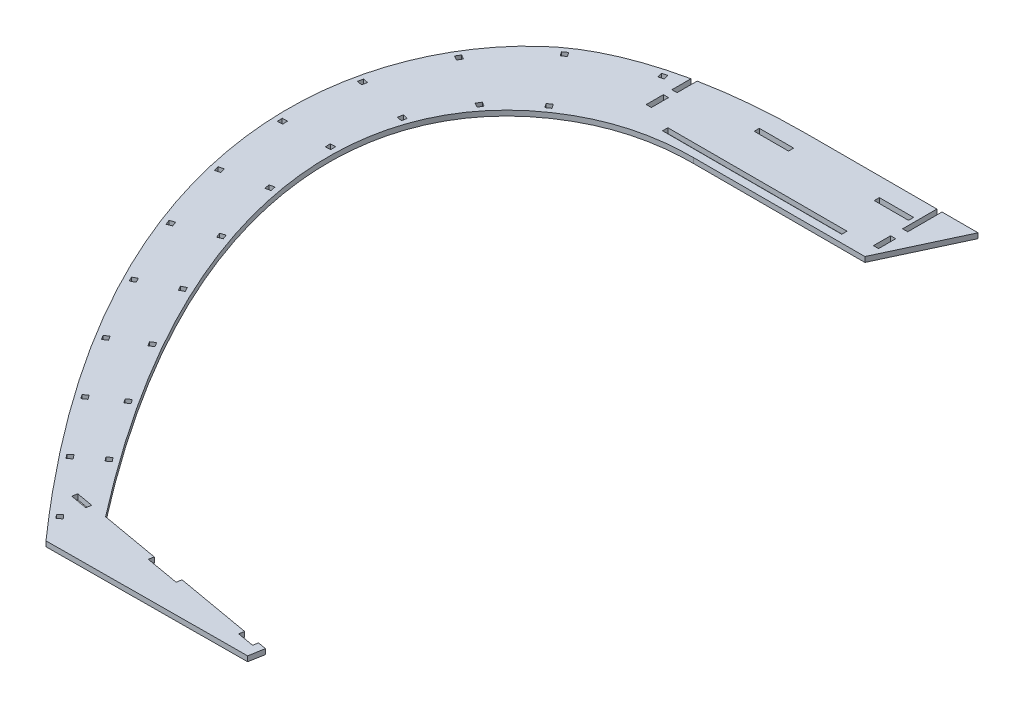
SolidWorks part; units mm, degrees
ref_plane "Front Plane" through (0, 0, 0) normal (0, 0, 1) x (1, 0, 0)
ref_plane "Top Plane" through (0, 0, 0) normal (0, 1, 0) x (1, 0, 0)
ref_plane "Right Plane" through (0, 0, 0) normal (1, 0, 0) x (0, 0, -1)
sketch "Sketch1" plane through (0, 0, 0) normal (0, 1, 0) x (1, 0, 0)
  line L0 (0, 300) -> (0, 250) construction
  line L1 (0, 300) -> (150, 300) construction
  line L2 (0, 250) -> (150, 250) construction
  line L3 (150, 300) -> (150, 250) construction
  line L4 (0, 134.7387) -> (-116.8574, 17.8813) construction
  line L5 (0, 0) -> (0, 134.7387) construction
  line L6 (-116.8574, 17.8813) -> (112.6432, -211.6192) construction
  line L7 (-81.502, 53.2367) -> (112.6432, -140.9086) construction
  line L8 (112.6432, -140.9086) -> (112.6432, -211.6192) construction
  line L9 (112.6432, -211.6192) -> (162.6432, -161.6192) construction
  line L10 (162.6432, -161.6192) -> (162.6432, -232.3299) construction
  line L11 (112.6432, -140.9086) -> (162.6432, -90.9086) construction
  circle A0 centre (0, 0) radius 300 construction
  circle A1 centre (0, 134.7387) radius 115.2613 construction
  circle A2 centre (0, 134.7387) radius 165.2613 construction
  circle A3 centre (162.6432, -161.6192) radius 70.7107 construction
  circle A4 centre (162.6432, -90.9086) radius 70.7107 construction
  point P3 (75, 250)
  point P11 (-81.502, 53.2367)
  dimension "D1" = 600
  dimension "D2" = 150
  dimension "D3" = 50
  dimension "D4" = 45
sketch "Sketch2" plane through (0, 0, 0) normal (0, 1, 0) x (1, 0, 0)
  line L0 (20.9838, 45) -> (0, 0) construction
  line L1 (10, -352.9066) -> (123.2529, -372.8762)
  line L2 (123.2529, -372.8762) -> (121.6901, -381.7394)
  line L3 (121.6901, -381.7394) -> (4.7906, -382.4509)
  line L4 (10, -352.9066) -> (4.7906, -382.4509) construction
  line L5 (20.9838, 45) -> (120.9838, 45)
  line L6 (120.9838, 45) -> (100, 0)
  line L7 (100, 0) -> (0, 0)
  line L8 (0, 0) -> (0, -110.6621) construction
  line L9 (50, -381.7394) -> (121.6901, -381.7394) construction
  line L10 (10, -352.9066) -> (50, -352.9066) construction
  line L11 (-66, -20) -> (0, -20) construction
  line L12 (-90, 20) -> (0, 20) construction
  line L13 (0, 20) -> (0, 0) construction
  line L14 (-40, -110.6621) -> (44.7394, -110.6621) construction
  line L15 (50, -110.6621) -> (50, -478.8076) construction
  spline S0 degree 3 poles (20.9838, 45) (-20.2558, 45) (-69.1326, 35.8836) (-141.8762, -17.4106) (-193.8055, -157.8474) (4.7906, -382.4509) knots 0 0 0 0 0.294229 0.394229 1 1 1 1
  spline S1 degree 3 poles (0, 0) (-24.996, 0) (-123.9056, -31.9645) (-137.3281, -162.5738) (10, -352.9066) knots 0 0 0 0 0.197472 1 1 1 1
  dimension "D1" = 45
  dimension "D2" = 100
  dimension "D3" = 115
  dimension "D4" = 385
  dimension "D5" = 9
  dimension "D6" = 100
  dimension "D7" = 40
  dimension "D8" = 115
  dimension "D9" = 30
  dimension "D10" = 90
  dimension "D11" = 66
  dimension "D12" = 20
  dimension "D13" = 20
  dimension "D14" = 50
extrude "Boss-Extrude1" add sketch "Sketch2" along normal blind 3
sketch "Sketch3" plane through (0, 0, 0) normal (0, 1, 0) x (1, 0, 0)
  line L0 (-51.9129, 33.2319) -> (-49.0162, 34.0121)
  line L1 (-51.9129, 33.2319) -> (-51.1328, 30.3352)
  line L2 (-49.0162, 34.0121) -> (-48.236, 31.1153)
  line L3 (-51.1328, 30.3352) -> (-48.236, 31.1153)
  line L4 (-89.5043, 16.7179) -> (-91.9494, 14.9798)
  line L5 (-89.5043, 16.7179) -> (-87.7661, 14.2728)
  line L6 (-91.9494, 14.9798) -> (-90.2113, 12.5346)
  line L7 (-87.7661, 14.2728) -> (-90.2113, 12.5346)
  line L8 (-120.9663, -18.3389) -> (-119.4273, -15.7637)
  line L9 (-120.9663, -18.3389) -> (-118.3911, -19.8779)
  line L10 (-119.4273, -15.7637) -> (-116.8521, -17.3027)
  line L11 (-118.3911, -19.8779) -> (-116.8521, -17.3027)
  line L12 (-135.8569, -56.5018) -> (-136.4986, -59.4323)
  line L13 (-135.8569, -56.5018) -> (-132.9263, -57.1435)
  line L14 (-136.4986, -59.4323) -> (-133.5681, -60.0741)
  line L15 (-132.9263, -57.1435) -> (-133.5681, -60.0741)
  line L16 (-139.8016, -100.0657) -> (-139.6788, -103.0632)
  line L17 (-139.8016, -100.0657) -> (-136.8041, -99.943)
  line L18 (-139.6788, -103.0632) -> (-136.6813, -102.9404)
  line L19 (-136.8041, -99.943) -> (-136.6813, -102.9404)
  line L20 (-51.1328, 30.3352) -> (-87.7661, 14.2728) construction
  line L21 (-90.2113, 12.5346) -> (-116.8521, -17.3027) construction
  line L22 (-118.3911, -19.8779) -> (-132.9263, -57.1435) construction
  line L23 (-133.5681, -60.0741) -> (-136.8041, -99.943) construction
  line L24 (-133.9752, -143.2286) -> (-133.2894, -146.1491)
  line L25 (-133.9752, -143.2286) -> (-131.0547, -142.5427)
  line L26 (-133.2894, -146.1491) -> (-130.3688, -145.4633)
  line L27 (-131.0547, -142.5427) -> (-130.3688, -145.4633)
  line L28 (-121.2031, -184.7151) -> (-120.1203, -187.5129)
  line L29 (-121.2031, -184.7151) -> (-118.4053, -183.6323)
  line L30 (-120.1203, -187.5129) -> (-117.3225, -186.4301)
  line L31 (-118.4053, -183.6323) -> (-117.3225, -186.4301)
  line L32 (-103.554, -224.2616) -> (-102.1882, -226.9326)
  line L33 (-103.554, -224.2616) -> (-100.883, -222.8957)
  line L34 (-102.1882, -226.9326) -> (-99.5172, -225.5668)
  line L35 (-100.883, -222.8957) -> (-99.5172, -225.5668)
  line L36 (-82.3978, -261.9679) -> (-80.824, -264.522)
  line L37 (-82.3978, -261.9679) -> (-79.8437, -260.3942)
  line L38 (-80.824, -264.522) -> (-78.2699, -262.9483)
  line L39 (-79.8437, -260.3942) -> (-78.2699, -262.9483)
  line L40 (-58.6351, -298.03) -> (-56.9039, -300.4801)
  line L41 (-58.6351, -298.03) -> (-56.185, -296.2988)
  line L42 (-56.9039, -300.4801) -> (-54.4538, -298.7489)
  line L43 (-56.185, -296.2988) -> (-54.4538, -298.7489)
  line L44 (-32.8737, -332.649) -> (-31.0196, -335.0075)
  line L45 (-32.8737, -332.649) -> (-30.5153, -330.7949)
  line L46 (-31.0196, -335.0075) -> (-28.6612, -333.1534)
  line L47 (-30.5153, -330.7949) -> (-28.6612, -333.1534)
  line L48 (-5.536, -366.0039) -> (-3.5836, -368.2816)
  line L49 (-5.536, -366.0039) -> (-3.2583, -364.0515)
  line L50 (-3.5836, -368.2816) -> (-1.3059, -366.3292)
  line L51 (-3.2583, -364.0515) -> (-1.3059, -366.3292)
  line L52 (-88.9887, 13.4037) -> (-69.0562, -14.8114) construction
  line L53 (-117.6216, -18.5903) -> (-90.3606, -34.8824) construction
  line L54 (-133.2472, -58.6088) -> (-106.4359, -64.4803) construction
  line L55 (-136.7427, -101.4417) -> (-112.8211, -100.4618) construction
  line L56 (-130.7118, -144.003) -> (-109.7317, -139.0763) construction
  line L57 (-117.8639, -185.0312) -> (-99.3976, -177.8842) construction
  line L58 (-100.2001, -224.2312) -> (-83.9353, -215.9142) construction
  line L59 (-79.0568, -261.6713) -> (-64.822, -252.9006) construction
  line L60 (-55.3194, -297.5239) -> (-43.0245, -288.8363) construction
  line L61 (-29.5882, -331.9741) -> (-19.1851, -323.7958) construction
  line L62 (-79.0224, -0.7039) -> (-75.3617, 1.8822) construction
  line L63 (-67.8285, -13.9495) -> (-70.2838, -15.6733)
  line L64 (-68.56, -18.1286) -> (-70.2838, -15.6733)
  line L65 (-66.1047, -16.4048) -> (-67.8285, -13.9495)
  line L66 (-103.9911, -26.7364) -> (-102.1882, -23.7197) construction
  line L67 (-91.1301, -36.17) -> (-89.5911, -33.5948)
  line L68 (-87.0159, -35.1338) -> (-89.5911, -33.5948)
  line L69 (-88.5549, -37.709) -> (-91.1301, -36.17)
  line L70 (-88.5549, -37.709) -> (-87.0159, -35.1338)
  line L71 (-119.8416, -61.5445) -> (-119.4273, -59.6527) construction
  line L72 (-124.7819, -100.9518) -> (-124.8403, -99.5263) construction
  line L73 (-120.2217, -141.5396) -> (-121.2031, -137.3605) construction
  line L74 (-108.6308, -181.4577) -> (-109.7317, -178.6132) construction
  line L75 (-92.0677, -220.0727) -> (-93.4934, -217.2847) construction
  line L76 (-106.115, -63.015) -> (-106.7568, -65.9455)
  line L77 (-103.8262, -66.5873) -> (-106.7568, -65.9455)
  line L78 (-103.1845, -63.6567) -> (-106.115, -63.015)
  line L79 (-103.1845, -63.6567) -> (-103.8262, -66.5873)
  line L80 (-112.8825, -98.9631) -> (-112.7597, -101.9606)
  line L81 (-109.7623, -101.8378) -> (-112.7597, -101.9606)
  line L82 (-109.885, -98.8403) -> (-112.8825, -98.9631)
  line L83 (-109.885, -98.8403) -> (-109.7623, -101.8378)
  line L84 (-110.0746, -137.616) -> (-109.3887, -140.5366)
  line L85 (-106.4682, -139.8507) -> (-109.3887, -140.5366)
  line L86 (-107.154, -136.9302) -> (-110.0746, -137.616)
  line L87 (-107.154, -136.9302) -> (-106.4682, -139.8507)
  line L88 (-99.939, -176.4853) -> (-98.8562, -179.2831)
  line L89 (-96.0584, -178.2003) -> (-98.8562, -179.2831)
  line L90 (-97.1412, -175.4025) -> (-99.939, -176.4853)
  line L91 (-97.1412, -175.4025) -> (-96.0584, -178.2003)
  line L92 (-84.6183, -214.5787) -> (-83.2524, -217.2497)
  line L93 (-80.5814, -215.8839) -> (-83.2524, -217.2497)
  line L94 (-81.9472, -213.2128) -> (-84.6183, -214.5787)
  line L95 (-81.9472, -213.2128) -> (-80.5814, -215.8839)
  line L96 (-71.9394, -257.2859) -> (-72.8997, -255.7274) construction
  line L97 (-49.1719, -293.1801) -> (-50.6326, -291.1129) construction
  line L98 (-24.3866, -327.885) -> (-25.7693, -326.1261) construction
  line L99 (-65.6089, -251.6235) -> (-64.0352, -254.1776)
  line L100 (-61.4811, -252.6039) -> (-64.0352, -254.1776)
  line L101 (-63.0548, -250.0498) -> (-65.6089, -251.6235)
  line L102 (-66.1047, -16.4048) -> (-68.56, -18.1286)
  line L103 (-63.0548, -250.0498) -> (-61.4811, -252.6039)
  line L104 (-43.8901, -287.6113) -> (-42.1589, -290.0614)
  line L105 (-39.7088, -288.3302) -> (-42.1589, -290.0614)
  line L106 (-41.44, -285.8801) -> (-43.8901, -287.6113)
  line L107 (-41.44, -285.8801) -> (-39.7088, -288.3302)
  line L108 (-20.1121, -322.6166) -> (-18.258, -324.975)
  line L109 (-15.8996, -323.1209) -> (-18.258, -324.975)
  line L110 (-17.7537, -320.7625) -> (-20.1121, -322.6166)
  line L111 (-17.7537, -320.7625) -> (-15.8996, -323.1209)
  line L120 (-136.6813, -102.9404) -> (-131.0547, -142.5427) construction
  line L121 (-130.3688, -145.4633) -> (-118.4053, -183.6323) construction
  line L122 (-117.3225, -186.4301) -> (-100.883, -222.8957) construction
  line L123 (-99.5172, -225.5668) -> (-79.8437, -260.3942) construction
  line L124 (-78.2699, -262.9483) -> (-56.185, -296.2988) construction
  line L125 (-54.4538, -298.7489) -> (-30.5153, -330.7949) construction
  line L126 (-28.6612, -333.1534) -> (-3.2583, -364.0515) construction
  spline S2 degree 3 poles (-2190.0758, -1695.3598) (1254.9787, -406.1387) (295.9011, 90.0628) (-43.1524, 35.9535) (-56.8912, 32.3435) (-71.6852, 26.401) (-74.525, 25.1413) (-78.5945, 23.1468) (-79.9194, 22.4645) (-82.5034, 21.0654) (-83.7629, 20.3483) (-89.9263, 16.6492) (-94.4294, 13.3302) (-99.98, 8.2962) (-101.0861, 7.245) (-103.3005, 5.0429) (-104.4098, 3.8916) (-107.7305, 0.2885) (-109.9348, -2.3135) (-116.4193, -10.73) (-120.5711, -17.1549) (-128.0054, -31.6968) (-131.2883, -39.8139) (-136.4592, -57.8153) (-138.3475, -67.6998) (-140.1957, -89.3171) (-140.1556, -101.0502) (-137.604, -126.4429) (-135.0922, -140.1025) (-123.0287, -184.0751) (-108.9461, -217.3832) (77.5267, -531.3275) (687.015, -1037.0415) (2600.1675, -1863.792) knots -2.552301 -2.552301 -2.552301 -2.552301 0.125 0.125 0.25 0.25 0.28125 0.28125 0.296875 0.296875 0.3125 0.3125 0.375 0.375 0.390625 0.390625 0.40625 0.40625 0.4375 0.4375 0.5 0.5 0.5625 0.5625 0.625 0.625 0.6875 0.6875 0.75 0.75 0.875 0.875 1.795359 1.795359 1.795359 1.795359 only from (20.9838, 42) to (7.038, -380.4637)
  spline S3 degree 3 poles (20.9838, 42) (3.6038, 42) (-12.9046, 40.7807) (-43.1524, 35.9535) (-56.8912, 32.3435) (-71.6852, 26.401) (-74.525, 25.1413) (-78.5945, 23.1468) (-79.9194, 22.4645) (-82.5034, 21.0654) (-83.7629, 20.3483) (-89.9263, 16.6492) (-94.4294, 13.3302) (-99.98, 8.2962) (-101.0861, 7.245) (-103.3005, 5.0429) (-104.4098, 3.8916) (-107.7305, 0.2885) (-109.9348, -2.3135) (-116.4193, -10.73) (-120.5711, -17.1549) (-128.0054, -31.6968) (-131.2883, -39.8139) (-136.4592, -57.8153) (-138.3475, -67.6998) (-140.1957, -89.3171) (-140.1556, -101.0502) (-137.604, -126.4429) (-135.0922, -140.1025) (-123.0287, -184.0751) (-108.9461, -217.3832) (-64.3507, -292.4637) (-33.8387, -334.2338) (7.038, -380.4637) knots 0 0 0 0 0.125 0.125 0.25 0.25 0.28125 0.28125 0.296875 0.296875 0.3125 0.3125 0.375 0.375 0.390625 0.390625 0.40625 0.40625 0.4375 0.4375 0.5 0.5 0.5625 0.5625 0.625 0.625 0.6875 0.6875 0.75 0.75 0.875 0.875 1 1 1 1 construction
  spline S4 degree 3 poles (2444.5357, -2086.8531) (764.9516, -1124.1501) (128.7896, -569.8188) (-68.6397, -247.4481) (-80.9998, -223.6027) (-99.5994, -179.5947) (-105.8404, -159.4308) (-111.1386, -131.7783) (-112.2268, -122.993) (-113.1265, -106.2656) (-112.9379, -98.3233) (-111.3601, -83.272) (-109.9704, -76.1631) (-106.0723, -62.7856) (-103.5634, -56.5175) (-97.5266, -44.8397) (-93.9989, -39.4307) (-86.0459, -29.4833) (-81.6212, -24.9452) (-74.4088, -18.7846) (-71.9088, -16.8386) (-68.0267, -14.079) (-66.7107, -13.1856) (-64.0365, -11.4515) (-62.6787, -10.6106) (-55.7681, -6.5312) (-49.8594, -3.6795) (-37.1832, 1.0096) (-30.4165, 2.8466) (156.4666, 35.0549) (626.1713, -296.8138) (2164.9222, -2052.6162) knots -1.312144 -1.312144 -1.312144 -1.312144 0.125 0.125 0.25 0.25 0.375 0.375 0.4375 0.4375 0.5 0.5 0.5625 0.5625 0.625 0.625 0.6875 0.6875 0.75 0.75 0.78125 0.78125 0.796875 0.796875 0.8125 0.8125 0.875 0.875 0.9375 0.9375 2.488682 2.488682 2.488682 2.488682 only from (5.2553, -356.5793) to (0, 6)
  spline S5 degree 3 poles (5.2553, -356.5793) (-17.8073, -326.7847) (-37.0438, -299.0392) (-68.6397, -247.4481) (-80.9998, -223.6027) (-99.5994, -179.5947) (-105.8404, -159.4308) (-111.1386, -131.7783) (-112.2268, -122.993) (-113.1265, -106.2656) (-112.9379, -98.3233) (-111.3601, -83.272) (-109.9704, -76.1631) (-106.0723, -62.7856) (-103.5634, -56.5175) (-97.5266, -44.8397) (-93.9989, -39.4307) (-86.0459, -29.4833) (-81.6212, -24.9452) (-74.4088, -18.7846) (-71.9088, -16.8386) (-68.0267, -14.079) (-66.7107, -13.1856) (-64.0365, -11.4515) (-62.6787, -10.6106) (-55.7681, -6.5312) (-49.8594, -3.6795) (-37.1832, 1.0096) (-30.4165, 2.8466) (-15.9401, 5.3416) (-8.231, 6) (0, 6) knots 0 0 0 0 0.125 0.125 0.25 0.25 0.375 0.375 0.4375 0.4375 0.5 0.5 0.5625 0.5625 0.625 0.625 0.6875 0.6875 0.75 0.75 0.78125 0.78125 0.796875 0.796875 0.8125 0.8125 0.875 0.875 0.9375 0.9375 1 1 1 1 construction
  dimension "D2" = 3
  dimension "D3" = 3
  dimension "D4" = 40
  dimension "D5" = 70
  dimension "D1" = 3
  dimension "D6" = 6
extrude "Cut-Extrude1" cut sketch "Sketch3" along normal blind 10
other "Flex1" [suppressed] parameters "D0"=5, "D1"=143.9595, "D2"=8.0555
sketch "Sketch4" plane through (0, 0, 0) normal (0, 1, 0) x (1, 0, 0)
  line L0 (-6.217, 32.5) -> (175.128, 32.5) construction
  line L1 (120.9838, 45) -> (20.9838, 45) construction
  line L2 (94.4555, 31) -> (114.4555, 31) construction
  line L3 (74.4555, 34) -> (94.4555, 34)
  line L4 (74.4555, 34) -> (74.4555, 31)
  line L5 (74.4555, 31) -> (94.4555, 31)
  line L6 (94.4555, 34) -> (94.4555, 31)
  line L7 (74.4555, 34) -> (94.4555, 31) construction
  line L8 (74.4555, 31) -> (94.4555, 34) construction
  line L9 (4.4555, 34) -> (24.4555, 34)
  line L10 (4.4555, 34) -> (4.4555, 31)
  line L11 (4.4555, 31) -> (24.4555, 31)
  line L12 (24.4555, 34) -> (24.4555, 31)
  line L13 (4.4555, 34) -> (24.4555, 31) construction
  line L14 (4.4555, 31) -> (24.4555, 34) construction
  line L15 (100, 0) -> (120.9838, 45) construction
  line L16 (100, 0) -> (100, 8) construction
  line L17 (4.4555, 31) -> (-37.5445, 31) construction
  line L18 (100, 8) -> (97, 8)
  line L19 (100, 8) -> (100, 18)
  line L20 (100, 18) -> (97, 18)
  line L21 (97, 8) -> (97, 18)
  line L22 (0, 0) -> (-37.5445, 0) construction
  line L23 (-37.5445, 0) -> (-37.5445, 13) construction
  line L25 (-37.5445, 13) -> (-40.5445, 13)
  line L26 (-37.5445, 13) -> (-37.5445, 23)
  line L27 (-37.5445, 23) -> (-40.5445, 23)
  line L28 (-40.5445, 13) -> (-40.5445, 23)
  point P4 (84.4555, 32.5)
  point P9 (14.4555, 32.5)
  dimension "D1" = 3
  dimension "D2" = 11
  dimension "D3" = 20
  dimension "D4" = 50
  dimension "D5" = 20
  dimension "D6" = 8
  dimension "D7" = 3
  dimension "D8" = 10
  dimension "D9" = 42
  dimension "D10" = 3
  dimension "D11" = 10
  dimension "D12" = 13
extrude "Cut-Extrude2" cut sketch "Sketch4" along normal blind 10
sketch "Sketch5" plane through (0, 0, 0) normal (0, 1, 0) x (1, 0, 0)
  line L0 (44.5834, 0) -> (44.5834, 4.5) construction
  line L1 (0, 0) -> (100, 0) construction
  line L2 (-37.5445, 6.05) -> (-22.5445, 6.05) construction
  line L3 (-22.5445, 7.6) -> (82, 7.6)
  line L4 (-22.5445, 7.6) -> (-22.5445, 4.5)
  line L5 (-22.5445, 4.5) -> (82, 4.5)
  line L6 (82, 7.6) -> (82, 4.5)
  line L7 (-37.5445, 13) -> (-37.5445, 23) construction
  line L8 (82, 6.05) -> (97, 6.05) construction
  line L9 (97, 18) -> (97, 8) construction
  dimension "D1" = 4.5
  dimension "D2" = 3.1
  dimension "D3" = 15
extrude "Cut-Extrude3" cut sketch "Sketch5" along normal blind 3
sketch "Sketch6" plane through (0, 0, 0) normal (0, 1, 0) x (1, 0, 0)
  line L0 (123.2529, -372.8762) -> (118.3289, -372.0079) construction
  line L1 (121.6901, -381.7394) -> (123.2529, -372.8762) construction
  line L2 (123.2529, -372.8762) -> (10, -352.9066) construction
  line L3 (118.3289, -372.0079) -> (108.4808, -370.2714)
  line L4 (118.3289, -372.0079) -> (117.8079, -374.9624)
  line L5 (108.4808, -370.2714) -> (107.9598, -373.2259)
  line L6 (117.8079, -374.9624) -> (107.9598, -373.2259)
  line L7 (118.3289, -372.0079) -> (-14.6202, -348.5654) construction
  line L8 (-14.6202, -348.5654) -> (-15.1411, -351.5198) construction
  line L9 (-15.1411, -351.5198) -> (117.8079, -374.9624) construction
  line L10 (117.8079, -374.9624) -> (118.3289, -372.0079) construction
  line L11 (-10.2171, -352.3881) -> (-9.6962, -349.4337)
  line L12 (-10.2171, -352.3881) -> (-0.369, -354.1246)
  line L13 (-9.6962, -349.4337) -> (0.1519, -351.1701)
  line L14 (-0.369, -354.1246) -> (0.1519, -351.1701)
  line L15 (54.3163, -360.7208) -> (53.7954, -363.6752) construction
  line L16 (43.9473, -361.9387) -> (63.6435, -365.4117)
  line L17 (43.9473, -361.9387) -> (44.4683, -358.9843)
  line L18 (63.6435, -365.4117) -> (64.1644, -362.4573)
  line L19 (44.4683, -358.9843) -> (64.1644, -362.4573)
  line L20 (43.9473, -361.9387) -> (64.1644, -362.4573) construction
  line L21 (63.6435, -365.4117) -> (44.4683, -358.9843) construction
  point P18 (54.0559, -362.198)
  point P19 (54.0559, -362.198)
  dimension "D1" = 0
  dimension "D2" = 5
  dimension "D3" = 3
  dimension "D4" = 10
  dimension "D5" = 135
  dimension "D6" = 3
  dimension "D7" = 10
  dimension "D8" = 5
  dimension "D9" = 20
  dimension "D10" = 70
extrude "Cut-Extrude4" cut sketch "Sketch6" along normal blind 3
sketch "Sketch7" plane through (0, 0, 0) normal (0, 1, 0) x (1, 0, 0)
  line L0 (97, 45) -> (100, 45)
  line L1 (97, 45) -> (97, 25)
  line L2 (100, 45) -> (100, 25)
  line L3 (97, 25) -> (100, 25)
  line L4 (120.9838, 45) -> (20.9838, 45) construction
  line L5 (100, 18) -> (97, 18) construction
  line L8 (97, 18) -> (97, 8) construction
  line L9 (-40.5445, 45) -> (-37.5445, 45)
  line L10 (-40.5445, 45) -> (-40.5445, 28)
  line L11 (-37.5445, 45) -> (-37.5445, 28)
  line L12 (-40.5445, 28) -> (-37.5445, 28)
  line L13 (-37.5445, 13) -> (-37.5445, 23) construction
  dimension "D1" = 20
  dimension "D2" = 17
extrude "Cut-Extrude5" cut sketch "Sketch7" along normal blind 3
